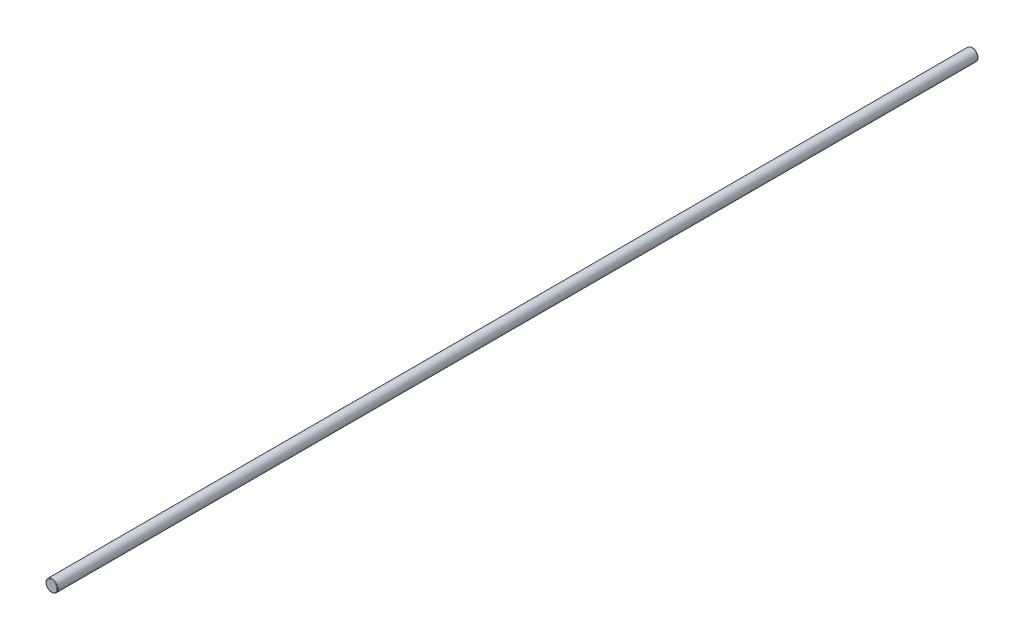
SolidWorks part; units mm, degrees
ref_plane "Face" through (0, 0, 0) normal (0, 0, 1) x (1, 0, 0)
ref_plane "Dessus" through (0, 0, 0) normal (0, 1, 0) x (1, 0, 0)
ref_plane "Droite" through (0, 0, 0) normal (1, 0, 0) x (0, 0, -1)
sketch "Esquisse1" plane through (0, 0, 0) normal (0, 0, 1) x (1, 0, 0)
  circle A0 centre (0, 0) radius 2.25
  dimension "D1" = 4.5
extrude "Extrusion1" add sketch "Esquisse1" along normal blind 349
fillet "Congé1" radius 0.2
